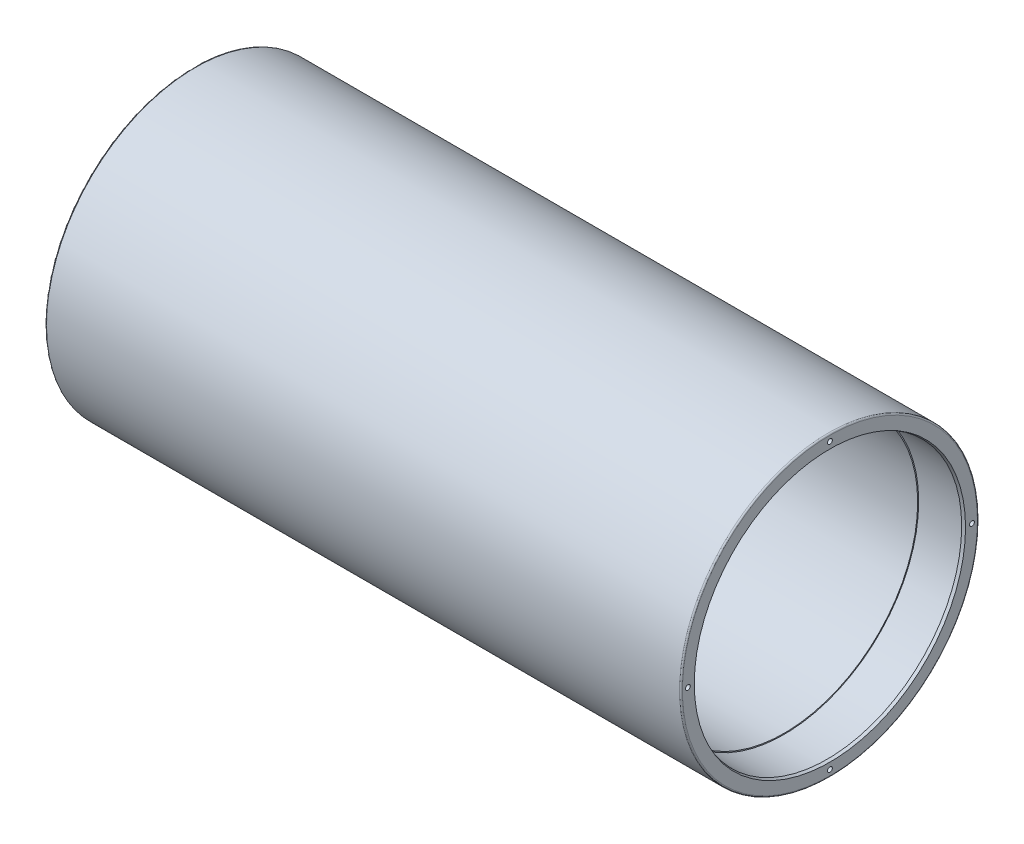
SolidWorks part; units mm, degrees
ref_plane "Front Plane" through (0, 0, 0) normal (0, 0, 1) x (1, 0, 0)
ref_plane "Top Plane" through (0, 0, 0) normal (0, 1, 0) x (1, 0, 0)
ref_plane "Right Plane" through (0, 0, 0) normal (1, 0, 0) x (0, 0, -1)
sketch "Sketch2" plane through (0, 0, 0) normal (0, 0, 1) x (1, 0, 0)
  line L0 (0, 82.55) -> (0, 66.675)
  line L1 (0, 66.675) -> (18.5691, 66.675)
  line L2 (18.5691, 66.675) -> (46.0594, 74.041)
  line L3 (46.0594, 74.041) -> (352.425, 74.041)
  line L4 (352.425, 74.041) -> (352.425, 82.55)
  line L5 (352.425, 82.55) -> (0, 82.55)
  line L6 (0, 0) -> (32.6208, 0) construction
  point P16 (352.425, 78.2955)
  dimension "D1" = 352.425
  dimension "D2" = 133.35
  dimension "D3" = 165.1
  dimension "D4" = 8.509
  dimension "D5" = 18.5691
  dimension "D6" = 333.8559
  dimension "D7" = 15
  dimension "D8" = 148.082
  dimension "D9" = 306.3656
ref_axis "Axis1" through (196.985, 0, 0) along (-1, 0, 0)
revolve "Revolve1" add sketch "Sketch2" angle 360 about axis through (196.985, 0, 0) along (-1, 0, 0)
sketch "Sketch5" plane through (0, 0, 0) normal (0, 0, 1) x (1, 0, 0)
  line L0 (0, 0) -> (203.5366, 0) construction
  line L1 (327.025, 74.6125) -> (365.5984, 74.6125)
  line L2 (327.025, 74.6125) -> (327.025, 67.6436)
  line L3 (327.025, 67.6436) -> (365.5984, 67.6436)
  line L4 (365.5984, 74.6125) -> (365.5984, 67.6436)
  line L5 (196.985, 0) -> (-166.235, 0) construction
  line L6 (352.425, -82.55) -> (352.425, 82.55) construction
  dimension "D1" = 149.225
  dimension "D2" = 25.4
revolve "Cut-Revolve1" cut sketch "Sketch5" angle 360 about L0
hole_wizard "#6-32 Tapped Hole1" positions "Sketch3" profile "Sketch4" tap size "#6-32" standard "ANSI Inch"
sketch "Sketch3" plane through (0, 0, 0) normal (-1, 0, 0) x (0, 0, 1)
  circle A1 centre (0, 0) radius 78.74
  point P19 (0, 78.74)
  dimension "D1" = 157.48
sketch "Sketch4" plane through (0, 78.74, 0) normal (0, 1, 0) x (0, 0, 1)
  line L0 (0, 0) -> (0, 10.2107)
  line L1 (0, 10.2107) -> (1.3525, 9.398)
  line L2 (1.3525, 9.398) -> (1.3525, 0)
  line L5 (1.3525, 0) -> (0, 0)
  line L10 (0, 10.2107) -> (-1.3526, 9.398) construction
  line L11 (0, -6.35) -> (0, 107.95) construction
  dimension "Tap Drill Dia." = 2.7051
  dimension "Tap Drill Depth" = 9.398
  dimension "Drill Angle" = 118
pattern_circular "CirPattern1" count 4 over 360 about axis through (0, 0, 0) along (1, 0, 0) of "#6-32 Tapped Hole1"
ref_plane "Plane1" through (176.2125, 0, 0) normal (-1, 0, 0) x (0, 0, 1)
mirror "Mirror1" about plane through (176.2125, 0, 0) normal (-1, 0, 0) of "CirPattern1", "#6-32 Tapped Hole1"
chamfer "Chamfer1" distance 1.5748 angle 20 1 edges at (0, 0, -66.675)
chamfer "Chamfer2" distance 1.5748 angle 20 1 edges at (352.425, 0, -74.6125)
fillet "Fillet1" radius 0.7937 2 edges at (0, 0, -82.55) (352.425, 0, -82.55)
equation "\"Air Weight\"= \"SW-Mass\""
equation "\"Buoyancy\"= \"SW-Volume\" * ( \"SW-Density\" - .037062 )"
